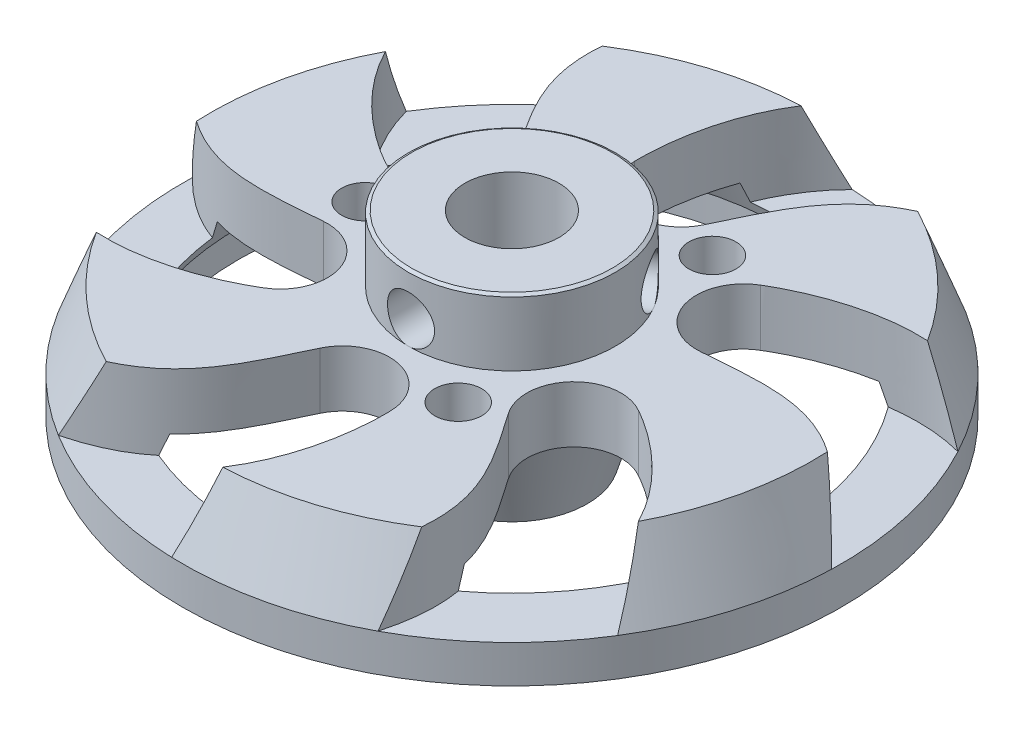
SolidWorks part; units mm, degrees
ref_plane "Front Plane" through (0, 0, 0) normal (0, 0, 1) x (1, 0, 0)
ref_plane "Top Plane" through (0, 0, 0) normal (0, 1, 0) x (1, 0, 0)
ref_plane "Right Plane" through (0, 0, 0) normal (1, 0, 0) x (0, 0, -1)
sketch "Sketch2" plane through (0, 0, 0) normal (0, 1, 0) x (1, 0, 0)
  circle A0 centre (0, 0) radius 17.5
extrude "Boss-Extrude1" add sketch "Sketch2" along normal blind 2
sketch "Sketch3" plane through (0, 2, 0) normal (0, 1, 0) x (1, 0, 0)
  circle A0 centre (0, 0) radius 17.5
extrude "Boss-Extrude2" add sketch "Sketch3" along normal blind 4 draft 20.6
shell "Shell1" thickness 3
sketch "Sketch4" plane through (0, 6, 0) normal (0, 1, 0) x (1, 0, 0)
  circle A0 centre (0, 0) radius 5.5
extrude "Boss-Extrude3" add sketch "Sketch4" along normal blind 3.5
chamfer "Chamfer1" distance 0.1 angle 60 1 edges at (0, 9.5, 5.5)
sketch "Sketch5" plane through (0, 3, 0) normal (0, -1, 0) x (1, 0, 0)
  circle A0 centre (0, 0) radius 5.5
extrude "Boss-Extrude4" add sketch "Sketch5" along normal blind 5 draft 16.7
sketch "Sketch6" plane through (0, 9.5, 0) normal (0, 1, 0) x (1, 0, 0)
  circle A0 centre (0, 0) radius 2.5
extrude "Cut-Extrude1" cut sketch "Sketch6" against normal through all
sketch "Sketch7" plane through (0, 6, 0) normal (0, 1, 0) x (1, 0, 0)
  line L1 (-9.1957, -14.8892) -> (-0.5798, -17.4904) construction
  line L3 (-0.5798, -17.4904) -> (9.8098, -17.4904) construction
  line L4 (7.6989, -9.2117) -> (-8.2883, -25.1989) construction
  line L6 (-9.1957, -14.8892) -> (-6.5177, -18.1411)
  line L7 (-6.5177, -18.1411) -> (-0.5798, -17.4904)
  arc A0 (2.5, -9) -> (-2.263, -7.9376) centre (0, -9) ccw
  circle A2 centre (0, 0) radius 17.5 construction
  spline S0 degree 3 poles (-0.5798, -17.4904) (2.7667, -14.1438) (2.4944, -9.0209) (2.5, -9) knots 0 0 0 0 1 1 1 1
  spline S2 degree 3 poles (-9.1957, -14.8892) (-4.8391, -13.7436) (-3.8352, -11.2385) (-2.263, -7.9376) knots 0 0 0 0 1 1 1 1
  dimension "D1" = 45
  dimension "D2" = 5
extrude "Cut-Extrude2" cut sketch "Sketch7" against normal blind 4
pattern_circular "CirPattern1" count 6 over 360 about axis through (0, 9.5, 0) along (0, -1, 0) of "Cut-Extrude2"
sketch "Sketch9" plane through (0, 6, 0) normal (0, 1, 0) x (1, 0, 0)
  line L0 (7.7942, -4.5) -> (0, -9) construction
  circle A0 centre (3.8971, -6.75) radius 1.25
extrude "Cut-Extrude3" cut sketch "Sketch9" against normal through all
pattern_circular "CirPattern2" count 3 over 360 about axis through (0, 0, 0) along (0, 1, 0) of "Cut-Extrude3"
sketch "Sketch10" plane through (0, 0, 0) normal (0, 0, 1) x (1, 0, 0)
  line L0 (5.3268, 9.5) -> (-5.3268, 9.5) construction
  circle A0 centre (0, 7.25) radius 1.25
  dimension "D1" = 2.5
  dimension "D2" = 2.25
extrude "Cut-Extrude4" cut sketch "Sketch10" along normal through all
pattern_circular "CirPattern3" count 3 over 360 about axis through (0, 9.5, 0) along (0, -1, 0) of "Cut-Extrude4"
